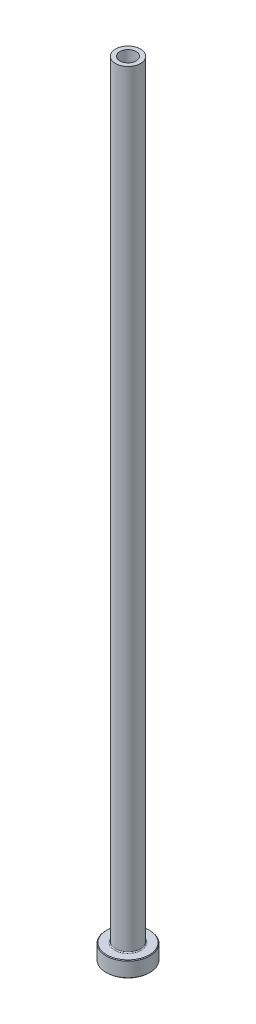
SolidWorks part; units mm, degrees
ref_plane "Front Plane" through (0, 0, 0) normal (0, 0, 1) x (1, 0, 0)
ref_plane "Top Plane" through (0, 0, 0) normal (0, 1, 0) x (1, 0, 0)
ref_plane "Right Plane" through (0, 0, 0) normal (1, 0, 0) x (0, 0, -1)
sketch "Sketch1" plane through (0, 0, 0) normal (0, 0, 1) x (1, 0, 0)
  line L0 (-2.6, 250) -> (-4, 250)
  line L1 (-4, 250) -> (-4, 5)
  line L2 (-4, 5) -> (-7, 5)
  line L3 (-7, 5) -> (-7, 0)
  line L4 (7.7, 0) -> (-7.7, 0) construction
  line L5 (-7, 0) -> (-2.85, 0)
  line L6 (-2.6, 205) -> (-2.6, 250)
  line L7 (0, 92.1877) -> (0, -15.5353) construction
  line L8 (0, -7.7) -> (0, 7.7) construction
  line L9 (-2.6, 205) -> (-2.85, 193)
  line L10 (-2.85, 193) -> (-2.85, 0)
  dimension "D1" = 0.25
  dimension "ID" = 5.2
  dimension "OD" = 8
  dimension "L" = 250
  dimension "H" = 14
  dimension "T" = 5
  dimension "N" = 45
  dimension "D2" = 12
revolve "Revolve1" add sketch "Sketch1" angle 360 about L7
fillet "Fillet1" radius 0.3 1 edges at (0, 5, 4)
chamfer "Chamfer1" distance 0.2 angle 45 2 edges at (0, 5, 7) (0, 0, 7)
chamfer "Chamfer3" distance 0.5 angle 45 1 edges at (0, 0, 2.85)
